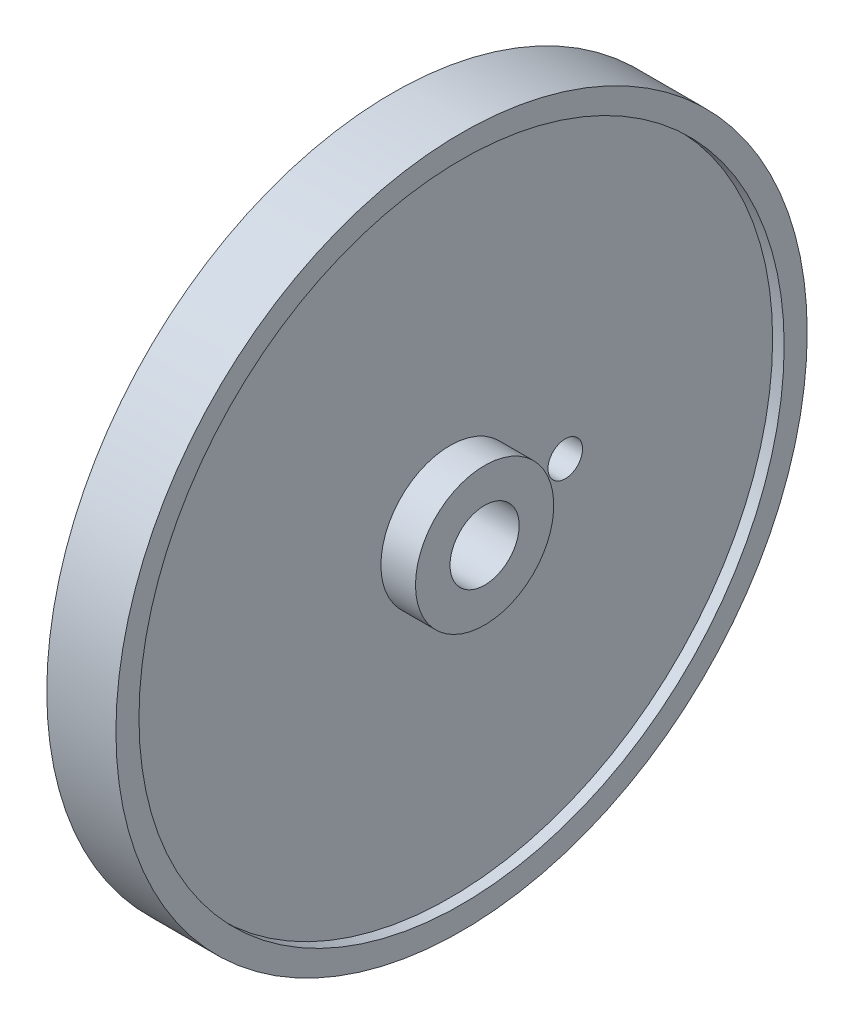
SolidWorks part; units mm, degrees
ref_plane "Front Plane" through (0, 0, 0) normal (0, 0, 1) x (1, 0, 0)
ref_plane "Top Plane" through (0, 0, 0) normal (0, 1, 0) x (1, 0, 0)
ref_plane "Right Plane" through (0, 0, 0) normal (1, 0, 0) x (0, 0, -1)
sketch "Sketch1" plane through (0, 0, 0) normal (0, 0, 1) x (1, 0, 0)
  line L0 (-5.7575, 0) -> (16.7609, 0) construction
  line L1 (0, 19.9595) -> (0, -6.9091) construction
  line L2 (-5, 3) -> (5, 3)
  line L3 (5, 3) -> (5, 6)
  line L4 (5, 6) -> (2, 6)
  line L5 (2, 6) -> (2, 28)
  line L6 (2, 28) -> (3, 28)
  line L7 (3, 28) -> (3, 30)
  line L8 (3, 30) -> (-3, 30)
  line L9 (-3, 28) -> (-3, 30)
  line L10 (-2, 28) -> (-3, 28)
  line L11 (-2, 6) -> (-2, 28)
  line L12 (-5, 6) -> (-2, 6)
  line L13 (-5, 3) -> (-5, 6)
  point P16 (0, 30)
  point P21 (0, 3)
  dimension "D1" = 10
  dimension "D2" = 3
  dimension "D3" = 3
  dimension "D4" = 30
  dimension "D5" = 2
  dimension "D6" = 4
  dimension "D7" = 6
revolve "Revolve1" add sketch "Sketch1" angle 360 about L0
sketch "Sketch3" plane through (2, 0, 0) normal (1, 0, 0) x (0, 0, -1)
  line L0 (0, 8.7718) -> (0, -9.5744) construction
  circle A0 centre (10, 0) radius 1.5
  dimension "D1" = 3
  dimension "D2" = 10
extrude "Extrude2" cut sketch "Sketch3" against normal blind 10
